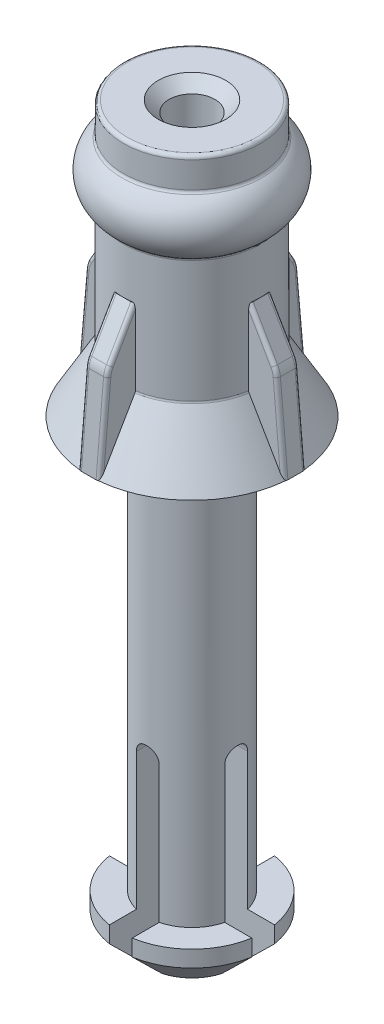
SolidWorks part; units mm, degrees
ref_plane "Front Plane" through (0, 0, 0) normal (0, 0, 1) x (1, 0, 0)
ref_plane "Top Plane" through (0, 0, 0) normal (0, 1, 0) x (1, 0, 0)
ref_plane "Right Plane" through (0, 0, 0) normal (1, 0, 0) x (0, 0, -1)
sketch "Sketch1" plane through (0, 0, 0) normal (0, 0, 1) x (1, 0, 0)
  line L0 (0, 0) -> (0, 54.4501) construction
  line L1 (1.5875, 50.8) -> (4.7625, 50.8)
  line L2 (4.7625, 50.8) -> (4.7625, 48.6008)
  line L3 (4.7625, 44.6172) -> (4.7625, 35.941)
  line L4 (4.7625, 35.941) -> (7.1822, 31.75)
  line L6 (7.1822, 31.75) -> (3.175, 31.75)
  line L8 (3.175, 31.75) -> (3.175, 3.175)
  line L10 (3.175, 3.175) -> (5.0165, 3.175)
  line L11 (5.0165, 3.175) -> (5.0165, 0)
  line L13 (5.0165, 0) -> (1.5875, 0)
  line L14 (8.255, 31.75) -> (-8.255, 31.75) construction
  line L15 (1.5875, 50.8) -> (1.5875, 0)
  line L16 (-5.3975, 0) -> (5.3975, 0) construction
  line L17 (12.7, 3.175) -> (-12.7, 3.175) construction
  arc A0 (4.7625, 48.6008) -> (4.7625, 44.6172) centre (3.4925, 46.609) cw
  dimension "D8" = 2.3622
  dimension "D1" = 4.191
  dimension "D2" = 50.8
  dimension "D3" = 9.525
  dimension "D4" = 6.35
  dimension "D5" = 10.033
  dimension "D6" = 4.191
  dimension "D7" = 30
  dimension "D9" = 6.985
  dimension "D10" = 3.175
revolve "Revolve1" add sketch "Sketch1" angle 360 about L0
chamfer "Chamfer1" distance 0.762 angle 45 2 edges at (0, 50.8, -1.5875) (0, 0, -1.5875)
sketch "Sketch4" plane through (0, 0, 0) normal (0, 0, 1) x (1, 0, 0)
  line L0 (0, 50.8) -> (0, 31.75) construction
  line L2 (-7.1822, 31.75) -> (7.1822, 31.75) construction
  line L3 (4.7625, 41.275) -> (6.4632, 38.3292)
  line L5 (6.6616, 37.7001) -> (7.1822, 31.75)
  line L6 (4.7625, 41.275) -> (4.0005, 41.275)
  line L7 (4.0005, 41.275) -> (4.0005, 31.75)
  line L8 (4.0005, 31.75) -> (7.1822, 31.75)
  line L9 (7.1822, 31.75) -> (4.7625, 35.941) construction
  line L10 (4.7625, 35.941) -> (4.7625, 44.6172) construction
  arc A0 (6.4632, 38.3292) -> (6.6616, 37.7001) centre (5.1434, 37.5672) cw
  dimension "D5" = 1.524
  dimension "D1" = 9.525
  dimension "D2" = 30
  dimension "D3" = 0.762
  dimension "D4" = 5
extrude "Extrude1" add sketch "Sketch4" along normal mid plane 1.524
sketch "Sketch3" plane through (0, 0, 0) normal (0, 0, 1) x (1, 0, 0)
  line L0 (0, 0) -> (0, 17.4915) construction
  line L1 (0.7937, 0) -> (0.7937, 12.7)
  line L2 (-2.3495, 0) -> (2.3495, 0) construction
  line L3 (-0.7937, 0) -> (-0.7937, 12.7)
  line L4 (-0.7937, 0) -> (0.7937, 0)
  arc A0 (0.7937, 12.7) -> (-0.7937, 12.7) centre (0, 12.7) ccw
  dimension "D1" = 12.7
  dimension "D2" = 1.5875
extrude "Cut-Extrude1" cut sketch "Sketch3" along normal through all
pattern_circular "CirPattern1" count 4 over 360 about axis through (0, 0, 0) along (0, 1, 0) of "Cut-Extrude1", "Extrude1"
chamfer "Chamfer2" distance 2.032 angle 45 4 edges at (-3.5472, 0, -3.5472) (3.5472, 0, -3.5472) (3.5472, 0, 3.5472) (-3.5472, 0, 3.5472)
fillet "Fillet4" radius 0.254 31 edges at (-0.762, 34.725, -6.9219) (-0.762, 38.0255, -6.5969) (0.762, 34.725, -6.9219) (0.762, 38.0255, -6.5969) (6.9219, 34.725, -0.762) (6.5969, 38.0255, -0.762) (6.9219, 34.725, 0.762) (6.5969, 38.0255, 0.762) (-6.9219, 34.725, -0.762) (-6.5969, 38.0255, -0.762) (-6.9219, 34.725, 0.762) (-6.5969, 38.0255, 0.762) (0.762, 34.725, 6.9219) (0.762, 38.0255, 6.5969) (-0.762, 34.725, 6.9219) (-0.762, 38.0255, 6.5969) (-0.762, 39.8021, -5.6129) (0.762, 39.8021, -5.6129) (3.3676, 35.941, -3.3676) (5.6129, 39.8021, -0.762) (5.6129, 39.8021, 0.762) (-5.6129, 39.8021, -0.762) (-5.6129, 39.8021, 0.762) (3.3676, 35.941, 3.3676) (0.762, 39.8021, 5.6129) (-0.762, 39.8021, 5.6129) (-3.3676, 35.941, 3.3676) (0, 44.6172, -4.7625) (0, 48.6008, -4.7625) (0, 50.8, -4.7625) (-3.3676, 35.941, -3.3676)
